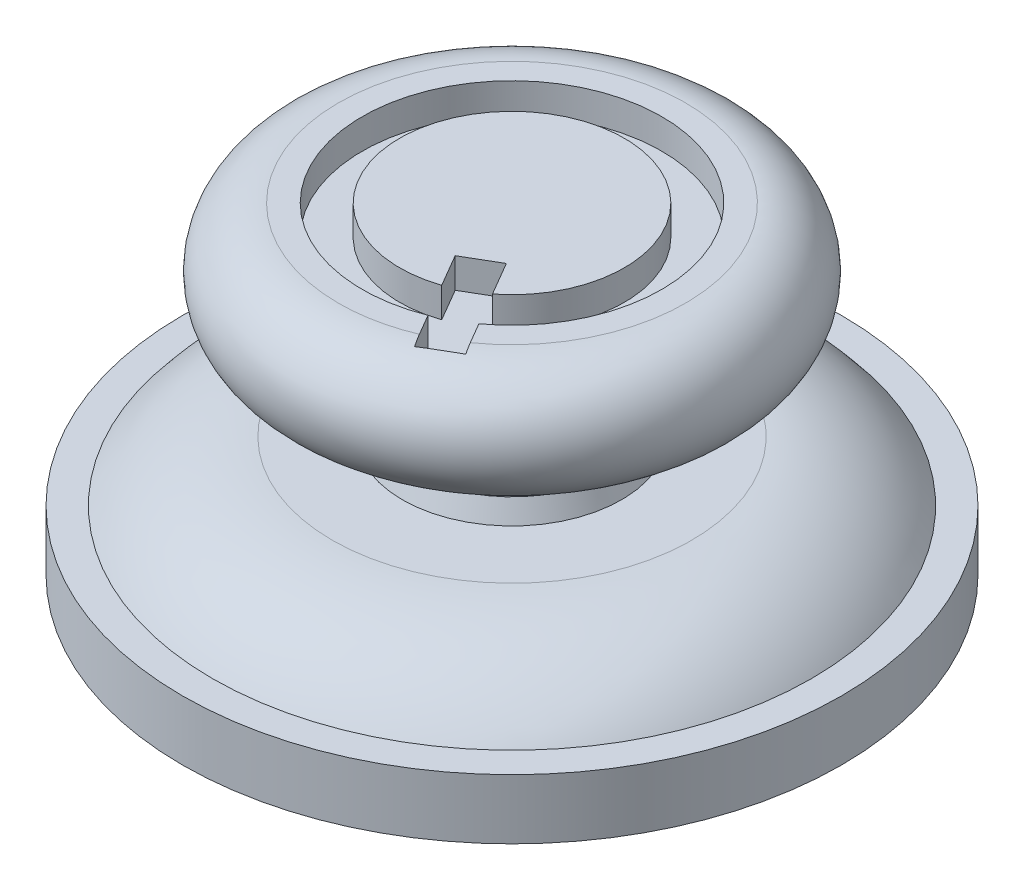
SolidWorks part; units mm, degrees
ref_plane "Front Plane" through (0, 0, 0) normal (0, 0, 1) x (1, 0, 0)
ref_plane "Top Plane" through (0, 0, 0) normal (0, 1, 0) x (1, 0, 0)
ref_plane "Right Plane" through (0, 0, 0) normal (1, 0, 0) x (0, 0, -1)
sketch "Sketch1" plane through (0, 0, 0) normal (0, 0, 1) x (1, 0, 0)
  line L0 (0, 8.274) -> (0, -6.744) construction
  line L10 (-3.6605, -0.9996) -> (-6, -0.9996)
  line L11 (-10, -2.9996) -> (-11, -2.9996)
  line L12 (-11, -2.9996) -> (-11, -4.9996)
  line L13 (-11, -4.9996) -> (-10, -4.9996)
  line L14 (-10, -4.9996) -> (-10, -3.4996)
  line L15 (-10, -3.4996) -> (0, -3.4996)
  line L16 (0, -3.4996) -> (0, 0)
  line L17 (-3.4167, -0.3299) -> (-3.6605, -0.9996)
  line L18 (0, 5.75) -> (0, 0)
  line L19 (0, 5.75) -> (-5.794, 5.75)
  arc A1 (-6, -0.9996) -> (-10, -2.9996) centre (-6, -5.9996) ccw
  arc A2 (-5.794, 5.75) -> (-5.794, 1.826) centre (-5.794, 3.788) ccw
  arc A3 (-5.794, 1.826) -> (-3.4167, -0.3299) centre (-5.794, -0.5627) cw
  point P20 (0, 5.75)
  point P21 (0, 5.75)
  point P22 (0, 5.651)
  dimension "D5" = 5
  dimension "D1" = 2
  dimension "D2" = 2
  dimension "D3" = 1
  dimension "D4" = 1.5
  dimension "D6" = 10
  dimension "D8" = 70
  dimension "D10" = 5.75
revolve "Revolve2" add sketch "Sketch1" angle 360 about L0
sketch "Sketch2" plane through (0, 5.75, 0) normal (0, 1, 0) x (1, 0, 0)
  line L0 (0.5743, -2.4718) -> (1.2044, -3.5513)
  line L1 (2.4742, -5.7271) -> (3.5538, -5.097)
  line L2 (3.5538, -5.097) -> (2.9396, -4.0446)
  line L3 (1.6538, -1.8417) -> (0.5743, -2.4718)
  line L4 (1.8441, -4.6475) -> (2.4742, -5.7271)
  line L5 (2.3053, -2.9578) -> (1.6538, -1.8417)
  arc A0 (2.9396, -4.0446) -> (1.8441, -4.6475) centre (0, 0) ccw
  arc A1 (2.3053, -2.9578) -> (1.2044, -3.5513) centre (0, 0) ccw
  dimension "D1" = 1.25
  dimension "D2" = 5
  dimension "D3" = 1.25
  dimension "D4" = 1.25
  dimension "D5" = 0.5
  dimension "D6" = 1.25
extrude "Cut-Extrude1" cut sketch "Sketch2" against normal blind 1
